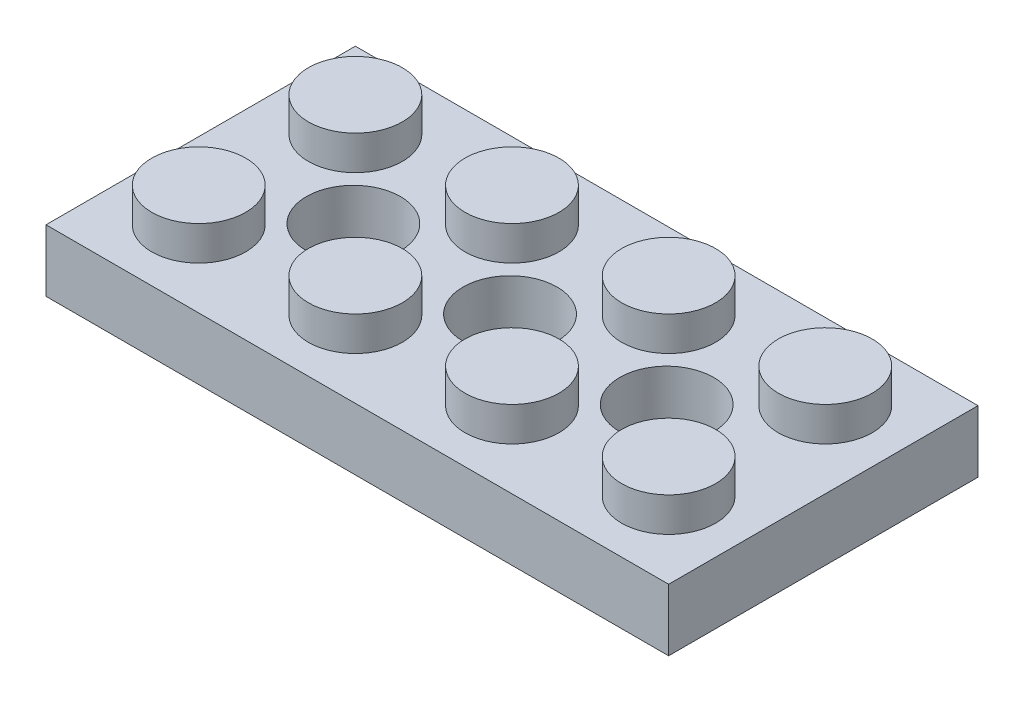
SolidWorks part; units mm, degrees
ref_plane "Front Plane" through (0, 0, 0) normal (0, 0, 1) x (1, 0, 0)
ref_plane "Top Plane" through (0, 0, 0) normal (0, 1, 0) x (1, 0, 0)
ref_plane "Right Plane" through (0, 0, 0) normal (1, 0, 0) x (0, 0, -1)
sketch "Sketch1" plane through (0, 0, 0) normal (0, 1, 0) x (1, 0, 0)
  line L1 (15.9, -7.9) -> (-15.9, -7.9)
  line L2 (15.9, -7.9) -> (15.9, 7.9)
  line L3 (15.9, 7.9) -> (-15.9, 7.9)
  line L4 (-15.9, -7.9) -> (-15.9, 7.9)
  line L5 (15.9, -7.9) -> (-15.9, 7.9) construction
  line L6 (15.9, 7.9) -> (-15.9, -7.9) construction
  point P0 (0, 0)
  dimension "D1" = 15.8
  dimension "D2" = 31.8
extrude "Extrude1" add sketch "Sketch1" along normal blind 3.166
sketch "Sketch2" plane through (0, 3.166, 0) normal (0, 1, 0) x (1, 0, 0)
  line L0 (12, -4) -> (12, -3.4252) construction
  circle A0 centre (12, 4) radius 2.4
  circle A1 centre (12, -4) radius 2.4
  dimension "D1" = 4.8
  dimension "D2" = 4.8
extrude "Extrude2" add sketch "Sketch2" along normal blind 1.75
sketch "Sketch3" plane through (0, 3.166, 0) normal (0, 1, 0) x (-1, 0, 0)
  line L0 (17.1927, 0) -> (-18.4099, 0) construction
sketch "Sketch4" plane through (0, 3.166, 0) normal (0, 1, 0) x (1, 0, 0)
  line L2 (-17.1927, 0) -> (18.4099, 0) construction
  line L3 (15.9, -7.9) -> (15.9, 7.9) construction
  circle A0 centre (7.9, 0) radius 2.4
  dimension "D1" = 8
  dimension "D2" = 4.8
sketch "Sketch5" plane through (0, 0, 0) normal (0, -1, 0) x (1, 0, 0)
  line L0 (-15.9, 7.9) -> (15.9, 7.9) construction
  line L1 (15.4, -7.4) -> (-15.4, -7.4)
  line L2 (15.4, -7.4) -> (15.4, 7.4)
  line L3 (15.4, 7.4) -> (-15.4, 7.4)
  line L4 (-15.4, -7.4) -> (-15.4, 7.4)
  line L5 (15.4, -7.4) -> (-15.4, 7.4) construction
  line L6 (15.4, 7.4) -> (-15.4, -7.4) construction
  line L7 (15.9, 7.9) -> (15.9, -7.9) construction
  point P0 (0, 0)
  dimension "D1" = 0.5
  dimension "D2" = 0.5
extrude "Extrude4" cut sketch "Sketch5" against normal blind 2.5
sketch "Sketch6" plane through (0, 2.5, 0) normal (0, -1, 0) x (1, 0, 0)
  line L0 (0, 0) -> (20.059, 0) construction
  line L1 (15.9, 7.9) -> (15.9, -7.9) construction
  circle A0 centre (7.9, 0) radius 3.4
  dimension "D1" = 6.8
  dimension "D2" = 8
extrude "Extrude5" add sketch "Sketch6" along normal blind 2.5
sketch "Sketch7" plane through (0, 0, 0) normal (0, -1, 0) x (1, 0, 0)
  circle A0 centre (7.9, 0) radius 2.4
  circle A1 centre (7.9, 0) radius 3.4 construction
  dimension "D1" = 4.8
extrude "Extrude6" cut sketch "Sketch7" against normal through all
sketch "Sketch8" plane through (0, 3.166, 0) normal (0, 1, 0) x (1, 0, 0)
  line L0 (-10.2073, 0) -> (17.0459, 0) construction
pattern_linear "LPattern1" count 4 spacing 8 along (-1, 0, 0) of "Extrude2"
pattern_linear "LPattern3" count 3 spacing 8 along (-1, 0, 0) of "Extrude6", "Extrude5"
